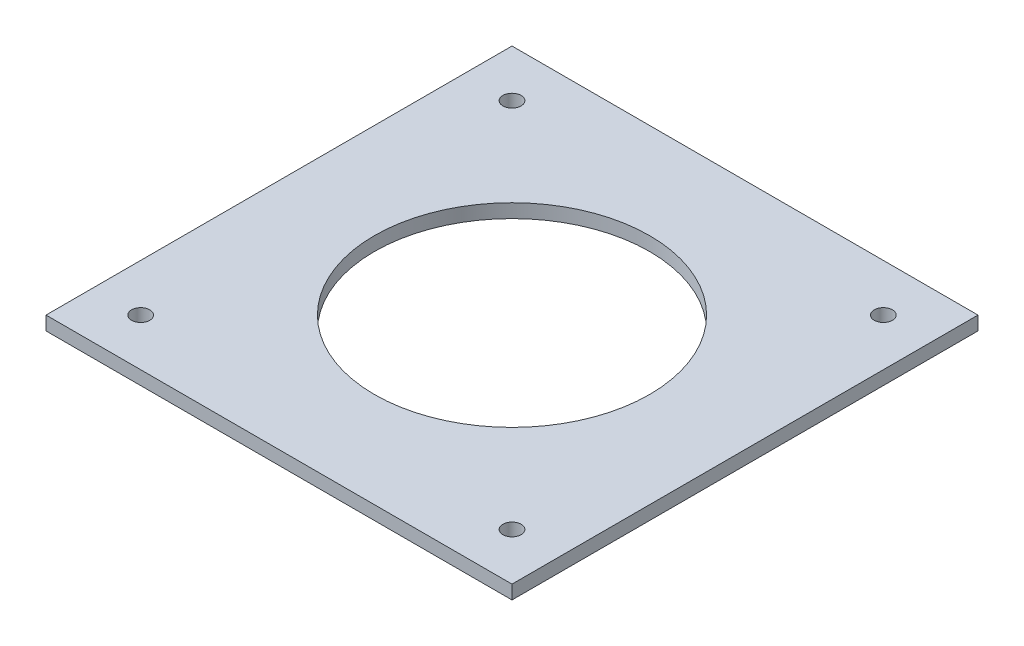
SolidWorks part; units mm, degrees
ref_plane "Front Plane" through (0, 0, 0) normal (0, 0, 1) x (1, 0, 0)
ref_plane "Top Plane" through (0, 0, 0) normal (0, 1, 0) x (1, 0, 0)
ref_plane "Right Plane" through (0, 0, 0) normal (1, 0, 0) x (0, 0, -1)
sketch "Sketch1" plane through (0, 0, 0) normal (0, 1, 0) x (1, 0, 0)
  line L1 (-50.8, 50.8) -> (50.8, 50.8)
  line L2 (-50.8, 50.8) -> (-50.8, -50.8)
  line L3 (-50.8, -50.8) -> (50.8, -50.8)
  line L4 (50.8, 50.8) -> (50.8, -50.8)
  line L5 (-50.8, 50.8) -> (50.8, -50.8) construction
  line L6 (-50.8, -50.8) -> (50.8, 50.8) construction
  line L7 (-40.48, 40.48) -> (40.48, 40.48) construction
  line L8 (-40.48, 40.48) -> (-40.48, -40.48) construction
  line L9 (-40.48, -40.48) -> (40.48, -40.48) construction
  line L10 (40.48, 40.48) -> (40.48, -40.48) construction
  circle A0 centre (0, 0) radius 30
  circle A1 centre (-40.48, 40.48) radius 1.985
  circle A2 centre (40.48, 40.48) radius 1.985
  circle A3 centre (40.48, -40.48) radius 1.985
  circle A4 centre (-40.48, -40.48) radius 1.985
  point P4 (0, 0)
  point P23 (0, 0)
  dimension "D2" = 60
  dimension "D4" = 3.97
  dimension "D1" = 101.6
  dimension "D3" = 80.96
  dimension "D5" = 4
extrude "Boss-Extrude1" add sketch "Sketch1" along normal blind 3
